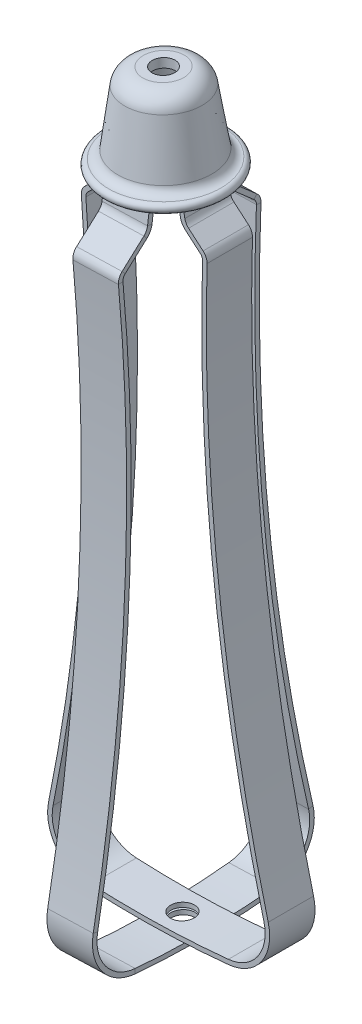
SolidWorks part; units mm, degrees
ref_plane "Front Plane" through (0, 0, 0) normal (0, 0, 1) x (1, 0, 0)
ref_plane "Top Plane" through (0, 0, 0) normal (0, 1, 0) x (1, 0, 0)
ref_plane "Right Plane" through (0, 0, 0) normal (1, 0, 0) x (0, 0, -1)
sketch "Sketch1" plane through (0, 0, 0) normal (0, 0, 1) x (1, 0, 0)
  line L0 (8.7861, 11.94) -> (10.3795, -48.91) construction
  line L2 (10.8555, -6.7194) -> (12.1088, -6.6866)
  line L3 (14.7794, -16.6504) -> (13.4259, -9.0044)
  line L4 (10.8888, -7.989) -> (12.1421, -7.9562)
  line L5 (16.03, -16.429) -> (14.6764, -8.783)
  line L6 (10.8555, -6.7194) -> (10.8888, -7.989)
  line L7 (17.3138, -17.4772) -> (17.3149, -17.4771)
  line L8 (0, 0) -> (0, -14.9901) construction
  arc A0 (17.3149, -17.4771) -> (17.3486, -18.7467) centre (17.3316, -18.1119) cw
  arc A1 (14.6764, -8.783) -> (12.1088, -6.6866) centre (12.1753, -9.2257) ccw
  arc A2 (13.4259, -9.0044) -> (12.1421, -7.9562) centre (12.1753, -9.2257) ccw
  arc A3 (16.03, -16.429) -> (17.3138, -17.4772) centre (17.2805, -16.2076) ccw
  arc A4 (14.7794, -16.6504) -> (17.3486, -18.7467) centre (17.2805, -16.2076) ccw
  point P17 (13.2352, -7.9276)
  dimension "D3" = 0.635
  dimension "D6" = 2.54
  dimension "D7" = 1.27
  dimension "D8" = 11.3925
  dimension "D4" = 2.54
  dimension "D1" = 1.27
  dimension "D2" = 1.27
  dimension "D5" = 6.7194
  dimension "D9" = 8.539
  dimension "D10" = 1.5802
  dimension "D11" = 9.2257
  dimension "D12" = 16.2076
  dimension "D13" = 1.5
  dimension "D14" = 10.8555
revolve "Revolve1" add sketch "Sketch1" angle 360 about L0
sketch "Sketch2" plane through (0, 0, 0) normal (0, 0, 1) x (1, 0, 0)
  line L0 (14.1803, -13.771) -> (15.4312, -20.5203)
  line L1 (15.9592, -21.4365) -> (17.9888, -23.1756)
  line L2 (9.0988, 0) -> (12.2653, -120.9255) construction
  line L4 (3.3697, -21.7661) -> (1.4339, -23.6091)
  line L5 (4.745, -14.018) -> (3.849, -20.8236)
  line L6 (0, 0) -> (0, 14.7786) construction
  arc A0 (18.5427, -24.4254) -> (27.1033, -100.0073) centre (289.5556, -32.0055) ccw
  arc A1 (0.9461, -24.8862) -> (-3.6471, -100.8125) centre (-269.2987, -46.6396) cw
  arc A2 (2.2683, -108.4239) -> (21.5944, -107.9179) centre (8.5401, 21.3335) ccw
  arc A3 (27.1033, -100.0073) -> (21.5944, -107.9179) centre (20.9563, -101.6) cw
  arc A4 (-3.6471, -100.8125) -> (2.2683, -108.4239) centre (2.5748, -102.0813) ccw
  arc A5 (17.9888, -23.1756) -> (18.5427, -24.4254) centre (16.9558, -24.381) cw
  arc A6 (15.4312, -20.5203) -> (15.9592, -21.4365) centre (16.9921, -20.231) ccw
  arc A7 (3.3697, -21.7661) -> (3.849, -20.8236) centre (2.2751, -20.6164) ccw
  arc A8 (0.9461, -24.8862) -> (1.4339, -23.6091) centre (2.5285, -24.7588) cw
  point P17 (29.002, -106.9538)
  point P20 (-5.1796, -107.8489)
  point P23 (18.5649, -23.6692)
  point P26 (15.5334, -21.0716)
  point P29 (3.7758, -21.3795)
  point P32 (0.8844, -24.1322)
  dimension "D1" = 6.35
  dimension "D2" = 1.5875
  dimension "D4" = 1.5875
  dimension "D11" = 271.1189
  dimension "D3" = 32.4859
  dimension "D5" = 9.4353
  dimension "D6" = 9
  dimension "D7" = 9.0988
  dimension "D8" = 106.9538
  dimension "D9" = 18.3815
  dimension "D10" = 1.5
  dimension "D12" = 102.0813
  dimension "D13" = 24.7588
  dimension "D14" = 14.018
  dimension "D15" = 24.1322
ref_plane "Plane1" through (14.1803, -13.771, 0) normal (0.1822, -0.9833, 0) x (0.9833, 0.1822, 0)
sketch "Sketch3" plane through (14.1803, -13.771, 0) normal (0.1822, -0.9833, 0) x (0.9833, 0.1822, 0)
  line L0 (0, 0) -> (-0.635, 0) construction
  line L1 (-0.635, -3.175) -> (0, -3.175)
  line L2 (-0.635, -3.175) -> (-0.635, 3.175)
  line L3 (-0.635, 3.175) -> (0, 3.175)
  line L4 (0, -3.175) -> (0, 3.175)
  dimension "D1" = 6.35
  dimension "D2" = 0.635
sweep "Sweep1" add profiles "Sketch3" path "Sketch2"
sketch "Sketch4" plane through (0, 0, 0) normal (0, 0, -1) x (1, 0, 0)
  line L0 (9.6321, 20.3647) -> (162.5505, 20.3647) construction
  line L2 (9.6321, 20.3647) -> (162.5505, 16.3604) construction
  dimension "D1" = 1.5
  dimension "D2" = 9.6321
  dimension "D3" = 20.3647
  dimension "D4" = 152.9185
ref_plane "Plane4" through (9.6321, -20.3647, 0) normal (0.9997, 0.0262, 0) x (0, -0.0009, -1)
sketch "Sketch5" plane through (9.6321, -20.3647, 0) normal (0.9997, 0.0262, 0) x (0, -0.0009, -1)
  line L0 (4.6988, 5.5879) -> (5.7747, -1.1234)
  line L1 (6.3029, -2.0722) -> (9.4238, -4.7749)
  line L4 (-6.3406, -2.0722) -> (-9.4615, -4.7749)
  line L5 (-4.7365, 5.5879) -> (-5.8124, -1.1234)
  line L6 (-0.0189, 20.6098) -> (-0.0189, -42.1464) construction
  arc A0 (9.9686, -6.0809) -> (15.3671, -80.9123) centre (280.483, -24.1757) ccw
  arc A1 (-10.0063, -6.0809) -> (-15.4325, -81.0418) centre (-280.5207, -24.1757) cw
  arc A2 (-9.7725, -88.6999) -> (9.7975, -88.5588) centre (-0.738, 15.4668) ccw
  arc A3 (15.3671, -80.9123) -> (9.7975, -88.5588) centre (9.1577, -82.2411) cw
  arc A4 (-15.4325, -81.0418) -> (-9.7725, -88.6999) centre (-9.2238, -82.3737) ccw
  arc A5 (9.4238, -4.7749) -> (9.9686, -6.0809) centre (8.3846, -5.9749) cw
  arc A6 (5.7747, -1.1234) -> (6.3029, -2.0722) centre (7.3422, -0.8721) ccw
  arc A7 (-6.3406, -2.0722) -> (-5.8124, -1.1234) centre (-7.3799, -0.8721) ccw
  arc A8 (-10.0063, -6.0809) -> (-9.4615, -4.7749) centre (-8.4223, -5.9749) cw
  point P17 (16.8858, -87.595)
  point P20 (-16.9782, -87.822)
  point P23 (10.0224, -5.2932)
  point P26 (5.8662, -1.6939)
  point P29 (-5.9039, -1.6939)
  point P32 (-10.0601, -5.2932)
  dimension "D1" = 6.35
  dimension "D2" = 1.5875
  dimension "D4" = 140
  dimension "D11" = 271.1189
  dimension "D3" = 32.4859
  dimension "D5" = 9.4353
  dimension "D6" = 26.5847
  dimension "D7" = 6.46
  dimension "D9" = 18.3815
  dimension "D10" = 87.829
  dimension "D12" = 93.1829
  dimension "D13" = 14.7221
  dimension "D14" = 15.0219
ref_plane "Plane5" through (9.4857, -14.7744, 4.7314) normal (-0.0258, 0.9869, -0.1592) x (-0.9997, -0.0255, 0.0041)
sketch "Sketch6" plane through (9.4857, -14.7744, 4.7314) normal (-0.0258, 0.9869, -0.1592) x (-0.9997, -0.0255, 0.0041)
  line L0 (0, 0) -> (0, -0.635) construction
  line L1 (-3.175, 0) -> (3.175, 0)
  line L2 (-3.175, 0) -> (-3.175, -0.635)
  line L3 (-3.175, -0.635) -> (3.175, -0.635)
  line L4 (3.175, 0) -> (3.175, -0.635)
  dimension "D1" = 0.635
  dimension "D2" = 6.35
sweep "Sweep2" add profiles "Sketch6" path "Sketch5"
ref_plane "Plane6" through (12.2653, -120.9255, 0) normal (0.0262, -0.9997, 0) x (0.9997, 0.0262, 0)
sketch "Sketch7" plane through (12.2653, -120.9255, 0) normal (0.0262, -0.9997, 0) x (0.9997, 0.0262, 0)
  circle A0 centre (0, 0) radius 1.651
  dimension "D1" = 3.302
extrude "Cut-Extrude1" cut sketch "Sketch7" against normal blind 18.288
